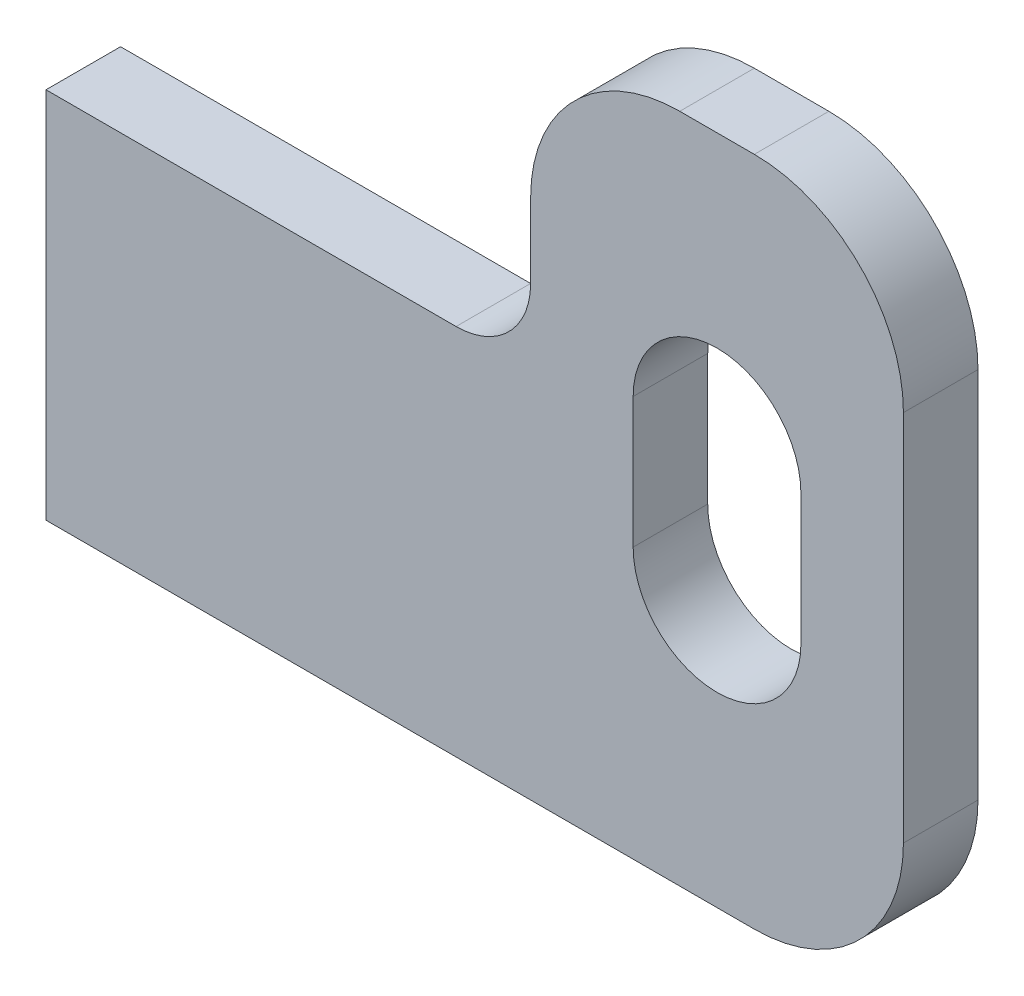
SolidWorks part; units mm, degrees
ref_plane "FRONT" through (0, 0, 0) normal (0, 0, 1) x (1, 0, 0)
ref_plane "TOP" through (0, 0, 0) normal (0, 1, 0) x (1, 0, 0)
ref_plane "RIGHT" through (0, 0, 0) normal (1, 0, 0) x (0, 0, -1)
sketch "Sketch1" plane through (0, 0, 0) normal (0, 0, 1) x (1, 0, 0)
  line L0 (7.1437, -5.5563) -> (7.1437, 5.5563)
  line L1 (-7.1437, 5.5563) -> (-7.1437, -5.5563)
  line L2 (-22.225, 3.175) -> (-57.15, 3.175)
  line L3 (-57.15, 3.175) -> (-57.15, -28.575)
  line L4 (-57.15, -28.575) -> (3.175, -28.575)
  line L5 (15.875, -15.875) -> (15.875, 15.875)
  line L6 (3.175, 28.575) -> (-3.175, 28.575)
  line L7 (-15.875, 15.875) -> (-15.875, 9.525)
  line L8 (0, 18.1889) -> (0, -23.6417) construction
  line L9 (-14.8265, 0) -> (25.145, 0) construction
  arc A0 (-7.1437, -5.5563) -> (7.1437, -5.5563) centre (0, -5.5563) ccw
  arc A1 (7.1437, 5.5563) -> (-7.1437, 5.5563) centre (0, 5.5563) ccw
  arc A2 (3.175, -28.575) -> (15.875, -15.875) centre (3.175, -15.875) ccw
  arc A3 (15.875, 15.875) -> (3.175, 28.575) centre (3.175, 15.875) ccw
  arc A4 (-3.175, 28.575) -> (-15.875, 15.875) centre (-3.175, 15.875) ccw
  arc A5 (-22.225, 3.175) -> (-15.875, 9.525) centre (-22.225, 9.525) ccw
  dimension "D4" = 12.7
  dimension "D8" = 7.1437
  dimension "D9" = 6.35
  dimension "D10" = 25.4
  dimension "D1" = 57.15
  dimension "D2" = 31.75
  dimension "D3" = 73.025
  dimension "D7" = 31.75
extrude "Extrude1" add sketch "Sketch1" along normal blind 6.35
